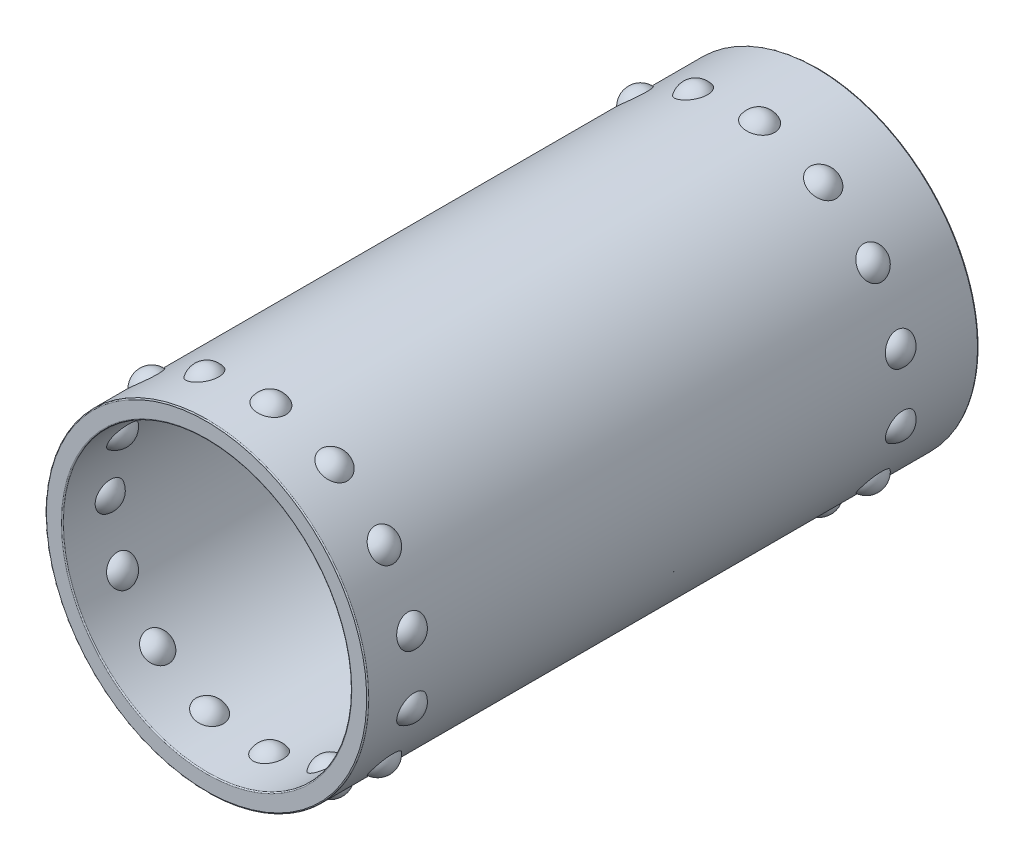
SolidWorks part; units mm, degrees
ref_plane "Front" through (0, 0, 0) normal (0, 0, 1) x (1, 0, 0)
ref_plane "Top" through (0, 0, 0) normal (0, 1, 0) x (1, 0, 0)
ref_plane "Right" through (0, 0, 0) normal (1, 0, 0) x (0, 0, -1)
sketch "Logo3_Revol_Axis" plane through (0, 0, 0) normal (0, 1, 0) x (1, 0, 0)
  line L0 (0, -30.1653) -> (0, 30.1653) construction
sketch "Logo3_bib1" plane through (0, 0, 0) normal (0, -1, 0) x (-1, 0, 0)
  line L0 (26.9875, 6.15) -> (26.9875, -107.75)
  line L1 (27.1875, -107.95) -> (29.9625, -107.95)
  line L2 (30.1625, -107.75) -> (30.1625, 6.15)
  line L3 (7.5, 0) -> (9.3, 0) construction
  line L7 (50.8, 0) -> (50.8, 2.6) construction
  line L9 (29.9625, 6.35) -> (27.1875, 6.35)
  line L10 (0, 41.5372) -> (0, -40.1764) construction
  arc A0 (30.1625, 6.15) -> (29.9625, 6.35) centre (29.9625, 6.15) ccw
  arc A1 (26.9875, 6.15) -> (27.1875, 6.35) centre (27.1875, 6.15) cw
  arc A2 (30.1625, -107.75) -> (29.9625, -107.95) centre (29.9625, -107.75) cw
  arc A3 (27.1875, -107.95) -> (26.9875, -107.75) centre (27.1875, -107.75) cw
  dimension "D1" = 0.2
  dimension "logo3_d1" = 50.8
  dimension "logo3_l1" = 114.3
  dimension "logo3_d1+db/2" = 53.975
  dimension "logo3_d1+1.5*db" = 60.325
  dimension "logo3_ld" = 6.35
revolve "Revolve1" add sketch "Logo3_bib1" angle 360 about L10
ref_plane "Plane1" through (0, 0, 7.62) normal (0, 0, 1) x (1, 0, 0)
sketch "Sketch3" plane through (0, 0, 7.62) normal (0, 0, 1) x (1, 0, 0)
  line L0 (0, 0) -> (-28.575, 0) construction
  line L1 (-25.4, 0) -> (-31.75, 0)
  line L2 (0, 0) -> (-4.9419, 1.7987) construction
  circle A0 centre (0, 0) radius 28.575 construction
  arc A1 (-25.4, 0) -> (-31.75, 0) centre (-28.575, 0) ccw
  dimension "logo3_d1+db" = 57.15
  dimension "logo3_db" = 6.35
  dimension "D2" = 20
revolve "Revolve6" add sketch "Sketch3" angle 360 about L0
pattern_circular "CirPattern6" count 15 over 360 about axis through (0, 0, 0) along (0, 0, 1) of "Revolve6"
pattern_linear "LPattern2" count 2 spacing 91.44 along (0, 0, 1) of "CirPattern6", "Revolve6"
